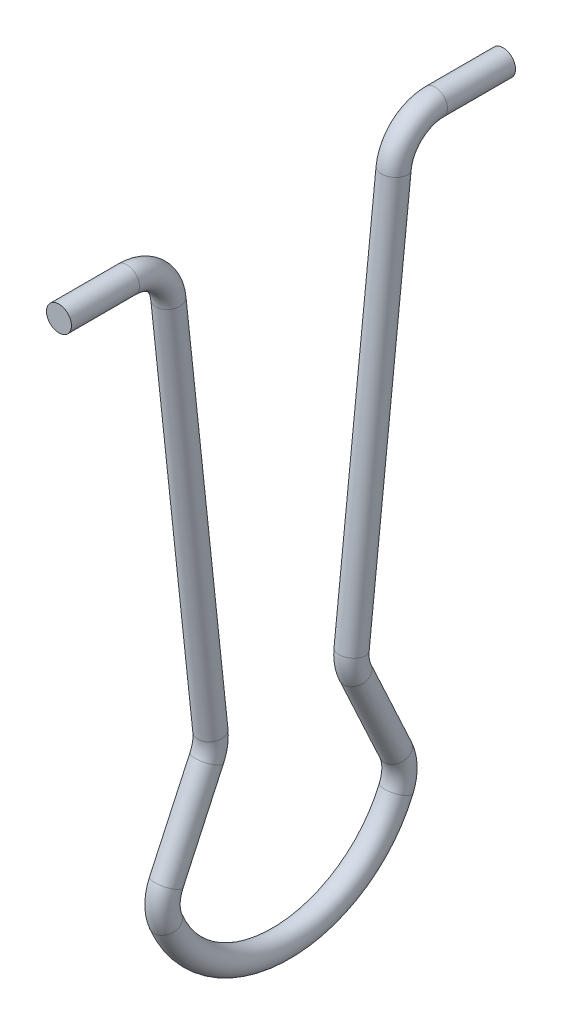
SolidWorks part; units mm, degrees
ref_plane "Front Plane" through (0, 0, 0) normal (0, 0, 1) x (1, 0, 0)
ref_plane "Top Plane" through (0, 0, 0) normal (0, 1, 0) x (1, 0, 0)
ref_plane "Right Plane" through (0, 0, 0) normal (1, 0, 0) x (0, 0, -1)
sketch "Sketch1" plane through (0, 0, 0) normal (1, 0, 0) x (0, 0, -1)
  line L0 (16, 0) -> (11.0981, 0)
  line L1 (8.1149, -2.683) -> (5.0876, -31.1758)
  line L2 (5.348, -32.7523) -> (8.2608, -39.0491)
  line L3 (0, 0) -> (0, -38) construction
  line L4 (-5.348, -32.7523) -> (-8.2608, -39.0491)
  line L5 (-8.1149, -2.683) -> (-5.0876, -31.1758)
  line L6 (-16, 0) -> (-11.0981, 0)
  arc A0 (8.3071, -41.463) -> (-8.3071, -41.463) centre (0, -38) cw
  arc A1 (8.2608, -39.0491) -> (8.3071, -41.463) centre (5.5381, -40.3087) cw
  arc A2 (-8.3071, -41.463) -> (-8.2608, -39.0491) centre (-5.5381, -40.3087) cw
  arc A3 (5.0876, -31.1758) -> (5.348, -32.7523) centre (8.0708, -31.4927) ccw
  arc A4 (-5.348, -32.7523) -> (-5.0876, -31.1758) centre (-8.0708, -31.4927) ccw
  arc A5 (-8.1149, -2.683) -> (-11.0981, 0) centre (-11.0981, -3) ccw
  arc A6 (11.0981, 0) -> (8.1149, -2.683) centre (11.0981, -3) ccw
  point P14 (8.75, -40.1065)
  point P17 (-8.75, -40.1065)
  point P20 (5, -32)
  point P23 (-5, -32)
  point P26 (-8.4, 0)
  point P29 (8.4, 0)
  dimension "D2" = 9
  dimension "D8" = 3
  dimension "D1" = 47
  dimension "D3" = 17.5
  dimension "D4" = 10
  dimension "D5" = 16.8
  dimension "D6" = 32
  dimension "D7" = 6
sweep "Sweep1" add path "Sketch1" parameters "D3"=1.8
